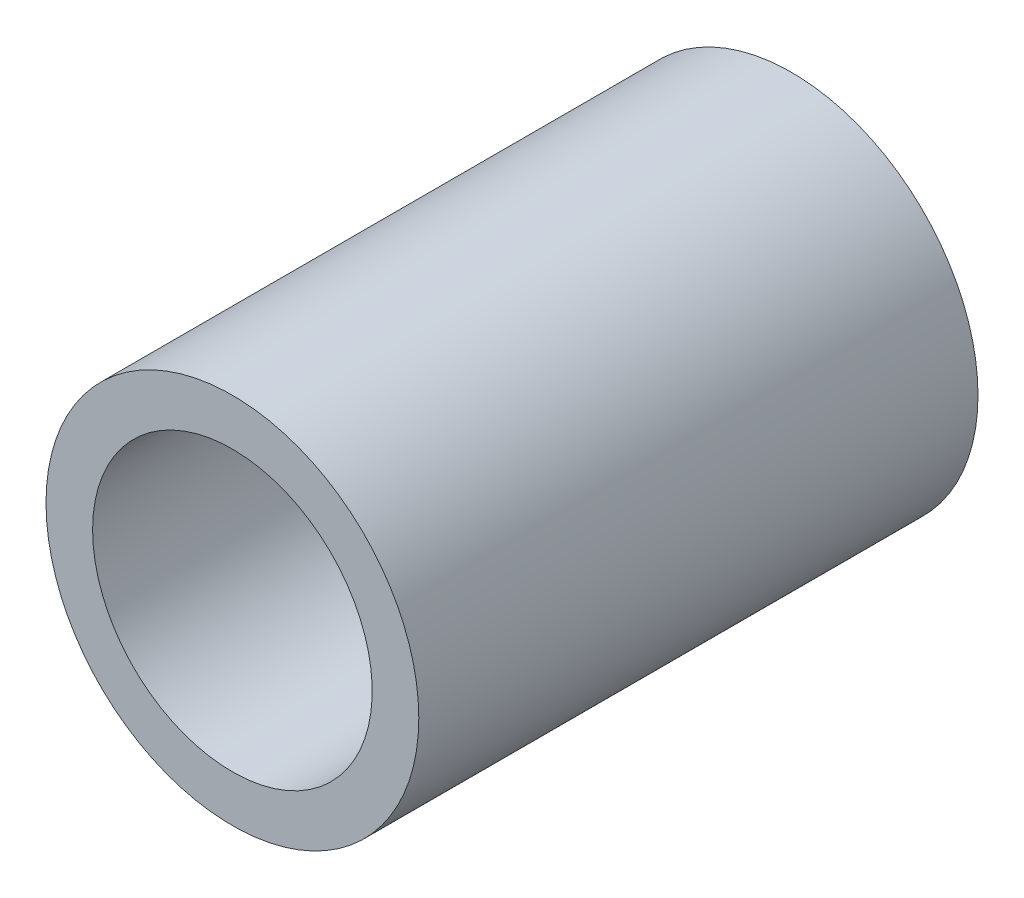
SolidWorks part; units mm, degrees
ref_plane "Plan de face" through (0, 0, 0) normal (0, 0, 1) x (1, 0, 0)
ref_plane "Plan de dessus" through (0, 0, 0) normal (0, 1, 0) x (1, 0, 0)
ref_plane "Plan de droite" through (0, 0, 0) normal (1, 0, 0) x (0, 0, -1)
sketch "Esquisse1" plane through (0, 0, 0) normal (0, 0, 1) x (1, 0, 0)
  circle A0 centre (0, 0) radius 20
  dimension "D1" = 40
extrude "Extru.-Mince1" add sketch "Esquisse1" along normal blind 60 thin
